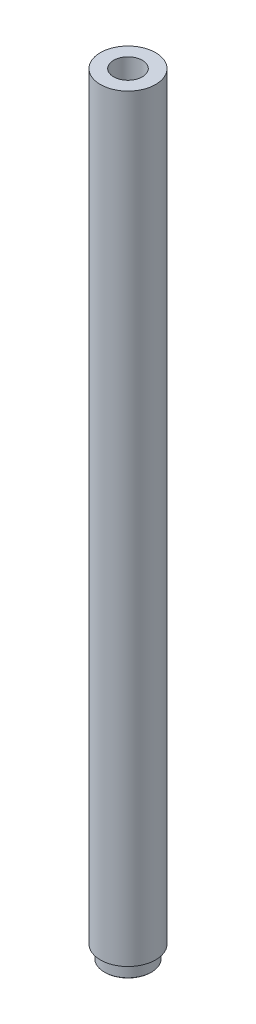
SolidWorks part; units mm, degrees
ref_plane "Front Plane" through (0, 0, 0) normal (0, 0, 1) x (1, 0, 0)
ref_plane "Top Plane" through (0, 0, 0) normal (0, 1, 0) x (1, 0, 0)
ref_plane "Right Plane" through (0, 0, 0) normal (1, 0, 0) x (0, 0, -1)
sketch "Sketch1" plane through (0, 0, 0) normal (0, 1, 0) x (1, 0, 0)
  circle A0 centre (0, 0) radius 6.35
  circle A1 centre (0, 0) radius 3.302
  dimension "D1" = 12.7
  dimension "D2" = 6.604
extrude "Boss-Extrude1" add sketch "Sketch1" along normal mid plane 174.2694
sketch "Sketch2" plane through (0, -87.1347, 0) normal (0, -1, 0) x (1, 0, 0)
  circle A0 centre (0, 0) radius 5.3975
  circle A1 centre (0, 0) radius 3.302
  circle A2 centre (0, 0) radius 3.302 construction
  dimension "D1" = 10.795
extrude "Boss-Extrude2" add sketch "Sketch2" along normal blind 3.048
chamfer "Chamfer1" distance 0.127 angle 45 1 edges at (0, -90.1827, -5.3975)
